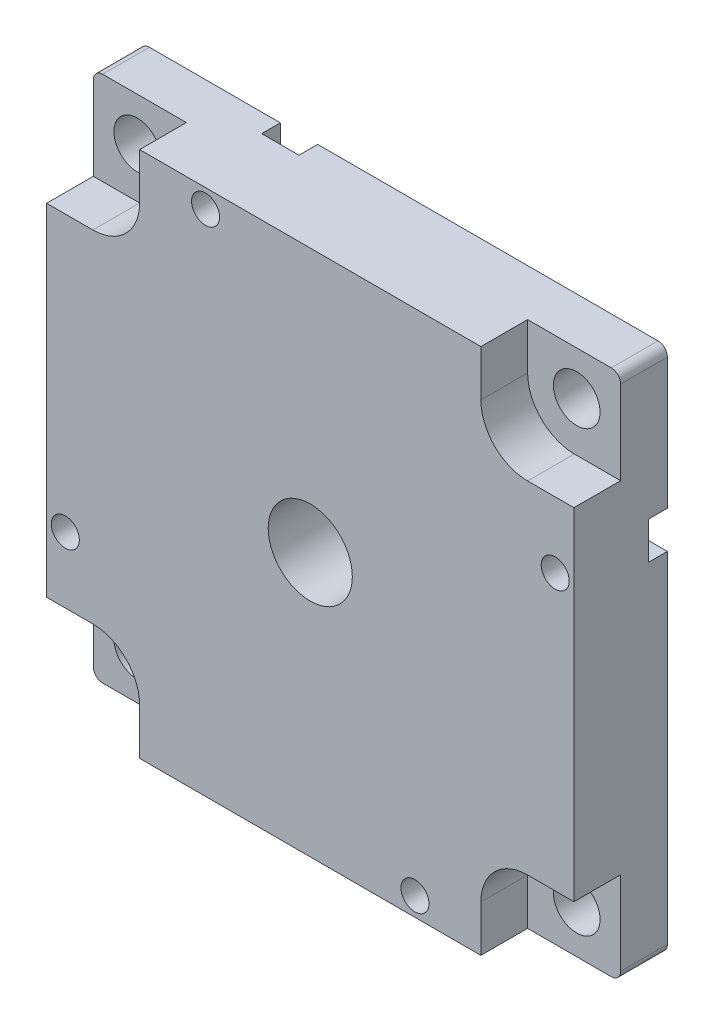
SolidWorks part; units mm, degrees
ref_plane "前视" through (0, 0, 0) normal (0, 0, 1) x (1, 0, 0)
ref_plane "上视" through (0, 0, 0) normal (0, 1, 0) x (1, 0, 0)
ref_plane "右视" through (0, 0, 0) normal (1, 0, 0) x (0, 0, -1)
sketch "草图2" plane through (0, 0, 0) normal (0, 0, 1) x (1, 0, 0)
  line L1 (28.2, -28.2) -> (-28.2, -28.2)
  line L2 (28.2, -28.2) -> (28.2, 28.2)
  line L3 (28.2, 28.2) -> (-28.2, 28.2)
  line L4 (-28.2, -28.2) -> (-28.2, 28.2)
  line L5 (28.2, -28.2) -> (-28.2, 28.2) construction
  line L6 (28.2, 28.2) -> (-28.2, -28.2) construction
  point P0 (0, 0)
  dimension "D1" = 56.4
  dimension "D2" = 56.4
extrude "凸台-拉伸1" add sketch "草图2" along normal blind 5
sketch "草图3" plane through (0, 0, 0) normal (0, 0, -1) x (-1, 0, 0)
  circle A0 centre (0, 0) radius 19
  circle A1 centre (0, 0) radius 20
extrude "切除-拉伸1" cut sketch "草图3" against normal blind 0.5
sketch "草图4" plane through (0, 0, 0) normal (0, 0, -1) x (-1, 0, 0)
  circle A0 centre (0, 0) radius 19
extrude "凸台-拉伸2" add sketch "草图4" along normal blind 1.6
sketch "草图5" plane through (0, 0, -1.6) normal (0, 0, -1) x (-1, 0, 0)
  circle A0 centre (0, 0) radius 4.5
extrude "切除-拉伸2" cut sketch "草图5" against normal blind 80
fillet "圆角1" radius 1 4 edges at (-28.2, 28.2, 2.5) (-28.2, -28.2, 2.5) (28.2, -28.2, 2.5) (28.2, 28.2, 2.5)
sketch "草图6" plane through (0, 0, 5) normal (0, 0, 1) x (1, 0, 0)
  line L0 (-28.2, 27.2) -> (-28.2, -27.2) construction
  line L1 (28.2, -18.25) -> (18.25, -18.25)
  line L2 (28.2, -18.25) -> (28.2, 18.25)
  line L3 (28.2, 18.25) -> (18.25, 18.25)
  line L4 (-28.2, -18.25) -> (-28.2, 18.25)
  line L5 (28.2, -18.25) -> (-28.2, 18.25) construction
  line L6 (28.2, 18.25) -> (-28.2, -18.25) construction
  line L7 (27.2, 28.2) -> (-27.2, 28.2) construction
  line L8 (18.25, -28.2) -> (-18.25, -28.2)
  line L9 (18.25, -28.2) -> (18.25, -18.25)
  line L10 (18.25, 28.2) -> (-18.25, 28.2)
  line L11 (-18.25, -28.2) -> (-18.25, -18.25)
  line L12 (18.25, -28.2) -> (-18.25, 28.2) construction
  line L13 (18.25, 28.2) -> (-18.25, -28.2) construction
  line L14 (-18.25, 18.25) -> (-18.25, 28.2)
  line L15 (-18.25, 18.25) -> (-28.2, 18.25)
  line L16 (18.25, 18.25) -> (18.25, 28.2)
  line L17 (-18.25, -18.25) -> (-28.2, -18.25)
  point P0 (0, 0)
  point P8 (0, 0)
  dimension "D1" = 36.5
  dimension "D2" = 36.5
extrude "凸台-拉伸3" add sketch "草图6" along normal blind 5
sketch "草图7" plane through (0, 0, 10) normal (0, 0, 1) x (1, 0, 0)
  circle A0 centre (0, 0) radius 4.5
extrude "切除-拉伸3" cut sketch "草图7" against normal blind 5.5
sketch "草图8" plane through (0, 0, 0) normal (0, 0, -1) x (-1, 0, 0)
  line L1 (23.5, -23.5) -> (-23.5, -23.5)
  line L2 (23.5, -23.5) -> (23.5, 23.5)
  line L5 (23.5, -23.5) -> (-23.5, 23.5) construction
  line L6 (23.5, 23.5) -> (-23.5, -23.5) construction
  circle A0 centre (-23.5, 23.5) radius 2.5
  point P0 (0, 0)
  dimension "D1" = 47
  dimension "D2" = 47
extrude "切除-拉伸4" cut sketch "草图8" against normal blind 5.5 contours A0
pattern_circular "阵列(圆周)1" count 4 over 360 about axis through (0, 0, 0) along (0, 0, 1) of "切除-拉伸4"
fillet "圆角2" radius 5 4 edges at (-18.25, -18.25, 7.5) (18.25, -18.25, 7.5) (18.25, 18.25, 7.5) (-18.25, 18.25, 7.5)
sketch "草图9" plane through (0, 0, 0) normal (0, 0, -1) x (-1, 0, 0)
  line L0 (9.2, 28.2) -> (13.2, 28.2)
  line L2 (13.2, 26.2) -> (13.2, 28.2)
  line L3 (-27.2, 28.2) -> (27.2, 28.2) construction
  line L5 (9.2, 26.2) -> (9.2, 28.2)
  arc A0 (9.2, 26.2) -> (13.2, 26.2) centre (11.2, 26.2) ccw
extrude "切除-拉伸5" cut sketch "草图9" against normal blind 2
pattern_circular "阵列(圆周)2" count 4 over 360 about axis through (0, 0, 0) along (0, 0, 1) of "切除-拉伸5"
sketch "草图10" plane through (0, 0, 2) normal (0, 0, -1) x (-1, 0, 0)
  circle A0 centre (11.2, 26.2) radius 1.5
extrude "切除-拉伸6" cut sketch "草图10" against normal blind 20
pattern_circular "阵列(圆周)3" count 4 over 360 about axis through (0, 0, 0) along (0, 0, 1) of "切除-拉伸6"
